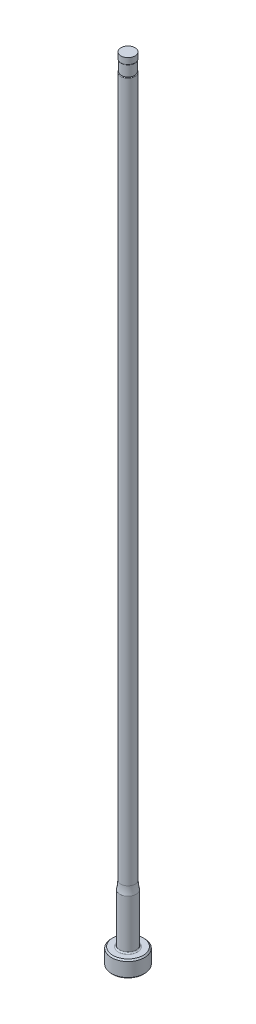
SolidWorks part; units mm, degrees
ref_plane "Front Plane" through (0, 0, 0) normal (0, 0, 1) x (1, 0, 0)
ref_plane "Top Plane" through (0, 0, 0) normal (0, 1, 0) x (1, 0, 0)
ref_plane "Right Plane" through (0, 0, 0) normal (1, 0, 0) x (0, 0, -1)
other "Configuration Table"
sketch "Sketch1" plane through (0, 0, 0) normal (0, 0, 1) x (1, 0, 0)
  line L0 (0, 259.9588) -> (0, -15.1925) construction
  line L1 (0, 0) -> (-3.175, 0)
  line L2 (-3.175, 0) -> (-3.175, 3.175)
  line L3 (-3.175, 3.175) -> (-1.5875, 3.175)
  line L4 (-1.3881, 14.2788) -> (-1.3881, 152.4)
  line L5 (-1.3881, 152.4) -> (0, 152.4)
  line L6 (0, 152.4) -> (0, 0)
  line L7 (-1.5875, 3.175) -> (-1.5875, 12.7)
  arc A1 (-1.5875, 12.7) -> (-1.3881, 14.2788) centre (-7.7381, 14.2788) ccw
  dimension "D1" = 6.35
  dimension "L" = 152.4
  dimension "D2" = 3.175
  dimension "H" = 6.35
  dimension "T" = 3.175
  dimension "D" = 2.7762
  dimension "S" = 12.7
revolve "Revolve1" add sketch "Sketch1" angle 360 about L0
chamfer "Chamfer1" distance 0.254 angle 45 2 edges at (0, 3.175, 3.175) (0, 0, 3.175)
fillet "Fillet1" radius 0.254 1 edges at (0, 3.175, 1.5875)
sketch "Sketch2" plane through (0, 0, 0) normal (0, 0, 1) x (1, 0, 0)
  line L0 (-1.3881, 152.4) -> (-1.3881, 14.2788) construction
  line L1 (-1.3881, 151.13) -> (-1.2865, 151.13)
  line L2 (-1.3881, 151.13) -> (-1.3881, 149.098)
  line L3 (-1.3881, 149.098) -> (-1.2865, 149.098)
  line L4 (-1.2865, 151.13) -> (-1.2865, 149.098)
  line L5 (1.3881, 152.4) -> (-1.3881, 152.4) construction
  line L6 (0, 153.4483) -> (0, 147.3282) construction
  dimension "D1" = 2.032
  dimension "N" = 1.27
  dimension "FD" = 0.1016
  dimension "D3" = 2.573
revolve "Vent Relief" cut sketch "Sketch2" angle 360 about L6
sketch "Sketch3" plane through (0, 0, 0) normal (0, 0, 1) x (1, 0, 0)
  line L0 (-1.2865, 150.114) -> (-1.2865, 112.014)
  line L1 (-1.2865, 151.13) -> (-1.2865, 149.098) construction
  line L2 (-1.3881, 149.098) -> (-1.3881, 14.2788) construction
  line L3 (-1.3881, 111.2172) -> (-1.3881, 150.114)
  line L4 (-1.3881, 150.114) -> (-1.2865, 150.114)
  arc A0 (-1.2865, 112.014) -> (-1.3881, 111.2172) centre (-4.4615, 112.014) cw
  dimension "D1" = 3.175
  dimension "D2" = 38.1
extrude "D-Slot" cut sketch "Sketch3" against normal through all both and the other way through all
sketch "Sketch5" plane through (0, 0, 0) normal (0, 0, 1) x (1, 0, 0)
  line L0 (-1.3881, 151.13) -> (1.3881, 151.13) construction
  line L1 (-1.3881, 152.4) -> (-1.3691, 152.4)
  line L2 (-1.3881, 152.4) -> (-1.3881, 151.13)
  line L3 (-1.3881, 151.13) -> (-1.3691, 151.13)
  line L4 (-1.3691, 152.4) -> (-1.3691, 151.13)
  line L5 (0, 152.6877) -> (0, 150.5771) construction
  dimension "VP" = 0.019
revolve "Vent Diameter" cut sketch "Sketch5" angle 360 about L5
fillet "Fillet2" radius 0.127 2 edges at (1.3881, 149.098, 0) (0, 151.13, 1.3691)
sketch "Pocket Sketch" plane through (0, 0, 0) normal (0, 0, 1) x (1, 0, 0)
  line L0 (-3.5719, 0) -> (-3.5719, 3.2004)
  line L1 (-3.5719, 3.2004) -> (-2.3485, 3.2004)
  line L2 (-1.5865, 3.9624) -> (-1.5865, 22.225)
  line L3 (-1.5865, 22.225) -> (0, 22.225)
  line L4 (0, 22.225) -> (0, 0)
  line L5 (0, 0) -> (-3.5719, 0)
  line L6 (0, 12.6104) -> (0, -2.4989) construction
  line L7 (-3.175, 2.921) -> (-3.175, 0.254) construction
  line L8 (2.921, 3.175) -> (-2.921, 3.175) construction
  line L9 (-1.3881, 111.2172) -> (-1.3881, 14.2788) construction
  line L10 (-2.3485, 3.2004) -> (-1.5865, 3.9624)
  point P3 (-1.5865, 3.2004)
  dimension "D1" = 7.1437
  dimension "D2" = 0.3969
  dimension "D3" = 0.0254
  dimension "D4" = 0.1984
  dimension "D5" = 3.1731
  dimension "D6" = 22.225
